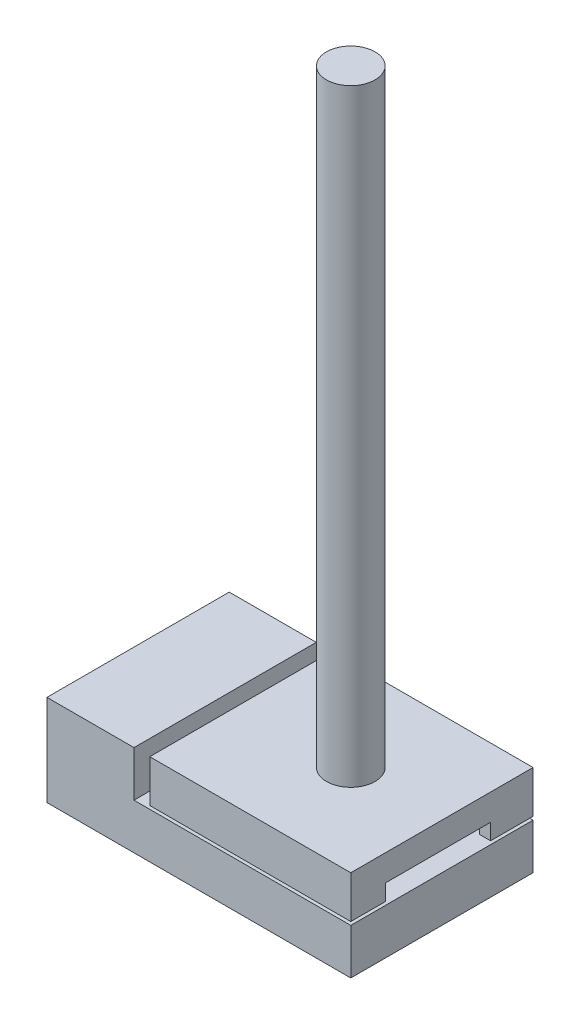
SolidWorks part; units mm, degrees
ref_plane "Front Plane" through (0, 0, 0) normal (0, 0, 1) x (1, 0, 0)
ref_plane "Top Plane" through (0, 0, 0) normal (0, 1, 0) x (1, 0, 0)
ref_plane "Right Plane" through (0, 0, 0) normal (1, 0, 0) x (0, 0, -1)
sketch "Sketch1" plane through (0, 0, 0) normal (0, 1, 0) x (1, 0, 0)
  line L1 (-50, 30) -> (50, 30)
  line L2 (-50, 30) -> (-50, -30)
  line L3 (-50, -30) -> (50, -30)
  line L4 (50, 30) -> (50, -30)
  line L5 (-50, 30) -> (50, -30) construction
  line L6 (-50, -30) -> (50, 30) construction
  point P0 (0, 0)
  dimension "D1" = 100
  dimension "D2" = 60
extrude "Boss-Extrude1" add sketch "Sketch1" along normal blind 30
sketch "Sketch2" plane through (0, 30, 0) normal (0, 1, 0) x (1, 0, 0)
  line L0 (0, 0) -> (50, 0) construction
  line L1 (50, -30) -> (50, 30) construction
  circle A0 centre (20, 0) radius 8
  dimension "D1" = 30
  dimension "D2" = 16
extrude "Boss-Extrude2" add sketch "Sketch2" along normal blind 200
sketch "Sketch3" plane through (0, 0, 30) normal (0, 0, 1) x (1, 0, 0)
  line L0 (-50, 30) -> (50, 30) construction
  line L1 (-21.3571, 30) -> (-16.1596, 30)
  line L2 (-21.3571, 30) -> (-21.3571, 15)
  line L3 (-21.3571, 15) -> (-16.1596, 15)
  line L4 (-16.1596, 30) -> (-16.1596, 15)
  line L5 (50, 30) -> (50, 0) construction
  line L6 (-16.1596, 16.0856) -> (50, 16.0856)
  line L7 (-16.1596, 16.0856) -> (-16.1596, 15)
  line L8 (-16.1596, 15) -> (50, 15)
  line L9 (50, 16.0856) -> (50, 15)
  point P12 (0, 0)
extrude "Cut-Extrude1" cut sketch "Sketch3" against normal blind 200 contours L4 L2 L3 M7 | L7 L6 L9 L8
sketch "Sketch4" plane through (50, 0, 0) normal (1, 0, 0) x (0, 0, -1)
  line L0 (30, 16.0856) -> (-30, 16.0856) construction
  line L1 (-18.5405, 16.0856) -> (16.0292, 16.0856)
  line L2 (-18.5405, 16.0856) -> (-18.5405, 21.3846)
  line L3 (-18.5405, 21.3846) -> (16.0292, 21.3846)
  line L4 (16.0292, 16.0856) -> (16.0292, 21.3846)
extrude "Cut-Extrude2" cut sketch "Sketch4" against normal blind 10
sketch "Sketch5" plane through (0, 0, -16.0292) normal (0, 0, 1) x (1, 0, 0)
  line L0 (40, 16.0856) -> (50, 16.0856) construction
  line L1 (43.8065, 16.0856) -> (46.3488, 16.0856)
  line L2 (43.8065, 16.0856) -> (43.8065, 21.3846)
  line L3 (43.8065, 21.3846) -> (46.3488, 21.3846)
  line L4 (46.3488, 16.0856) -> (46.3488, 21.3846)
  line L5 (40, 21.3846) -> (50, 21.3846) construction
extrude "Cut-Extrude3" cut sketch "Sketch5" against normal blind 4
sketch "Sketch6" plane through (0, 0, 0) normal (0, -1, 0) x (1, 0, 0)
  line L0 (-50, -30) -> (-50, 30) construction
  line L1 (-50, -30) -> (-50, 30)
  arc A0 (-50, -30) -> (-50, 30) centre (24.0249, 0) cw
extrude "Boss-Extrude3" add sketch "Sketch6" against normal blind 20
